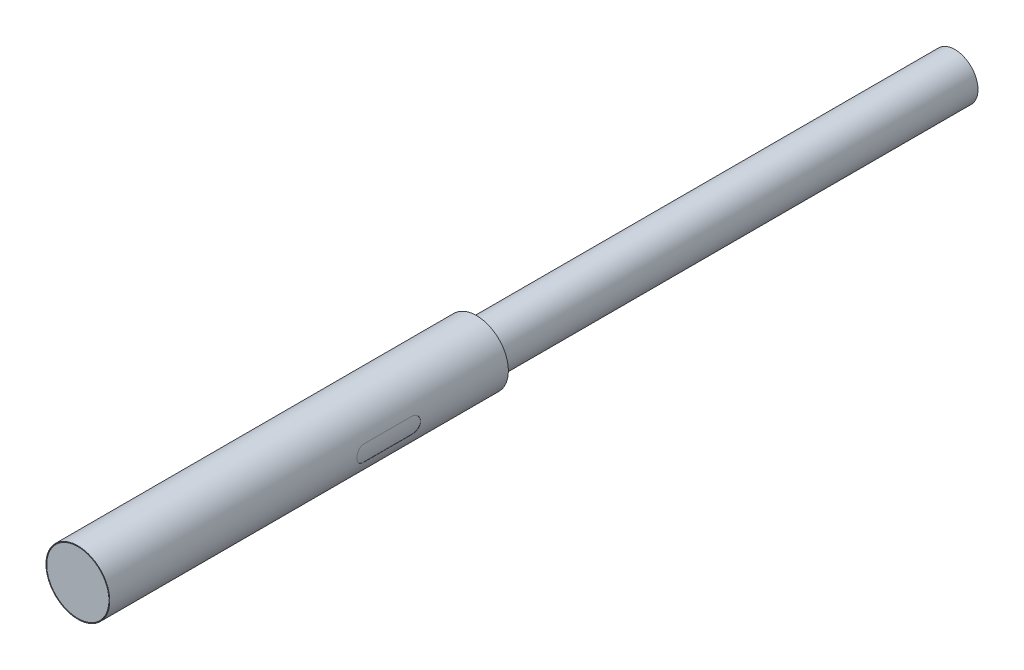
SolidWorks part; units mm, degrees
ref_plane "前视基准面" through (0, 0, 0) normal (0, 0, 1) x (1, 0, 0)
ref_plane "上视基准面" through (0, 0, 0) normal (0, 1, 0) x (1, 0, 0)
ref_plane "右视基准面" through (0, 0, 0) normal (1, 0, 0) x (0, 0, -1)
sketch "草图2" plane through (0, 0, 0) normal (0, 0, 1) x (1, 0, 0)
  circle A0 centre (0, 0) radius 2
  dimension "D1" = 4
extrude "凸台-拉伸1" add sketch "草图2" against normal blind 25 contours A0
sketch "草图3" plane through (0, 0, 0) normal (0, 0, 1) x (1, 0, 0)
  circle A0 centre (0, 0) radius 1.95
  circle A1 centre (0, 0) radius 1.975
  dimension "D1" = 3.95
  dimension "D2" = 3.9
extrude "切除-拉伸1" cut sketch "草图3" against normal blind 0.1
sketch "草图4" plane through (0, 0, -25) normal (0, 0, -1) x (-1, 0, 0)
  circle A0 centre (0, 0) radius 1.45
  dimension "D1" = 2.9
extrude "凸台-拉伸2" add sketch "草图4" along normal blind 30
ref_plane "基准面1" through (5, 0, 0) normal (1, 0, 0) x (0, 0, -1)
sketch "草图6" plane through (5, 0, 0) normal (1, 0, 0) x (0, 0, -1)
  line L0 (16, 0) -> (19, 0) construction
  line L1 (16, 0.5) -> (19, 0.5)
  line L2 (16, -0.5) -> (19, -0.5)
  line L3 (0, 2) -> (0, -2) construction
  arc A0 (16, 0.5) -> (16, -0.5) centre (16, 0) ccw
  arc A1 (19, -0.5) -> (19, 0.5) centre (19, 0) ccw
  point P2 (17.5, 0)
  dimension "D1" = 4
  dimension "D2" = 1
  dimension "D3" = 17.5
wrap "包覆1" sketch "草图6" wrap type deboss source sketch "草图6" thickness 0.01 parameters "D1"=0.01
